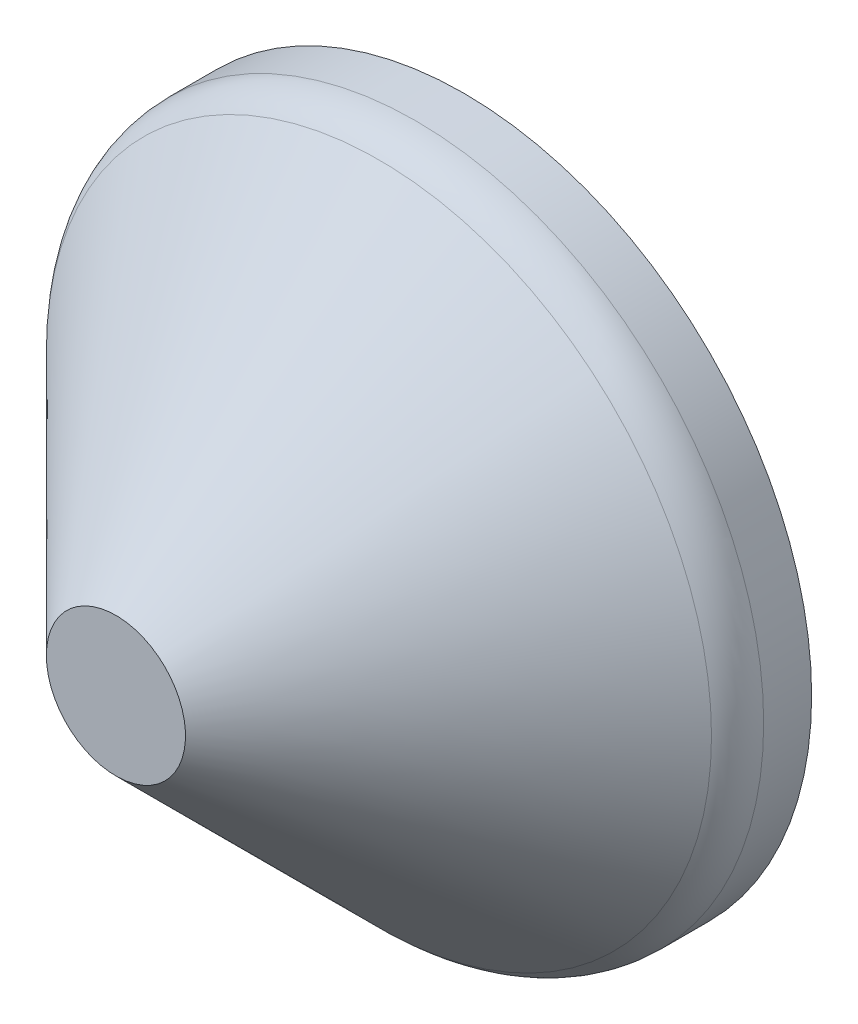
SolidWorks part; units mm, degrees
ref_plane "Front Plane" through (0, 0, 0) normal (0, 0, 1) x (1, 0, 0)
ref_plane "Top Plane" through (0, 0, 0) normal (0, 1, 0) x (1, 0, 0)
ref_plane "Right Plane" through (0, 0, 0) normal (1, 0, 0) x (0, 0, -1)
sketch "Sketch1" plane through (0, 0, 0) normal (0, 1, 0) x (1, 0, 0)
  line L0 (0, 0) -> (254, 0)
  line L1 (254, 0) -> (254, -50.8)
  line L2 (254, -50.8) -> (50.8, -254)
  line L3 (50.8, -254) -> (0, -254)
  line L4 (0, -254) -> (0, 0)
  dimension "D1" = 254
  dimension "D2" = 254
  dimension "D3" = 50.8
  dimension "D4" = 50.8
revolve "Revolve1" add sketch "Sketch1" angle 360 about L4
fillet "Fillet1" radius 38.1 1 edges at (254, 0, 50.8)
shell "Shell1" thickness 25.4
